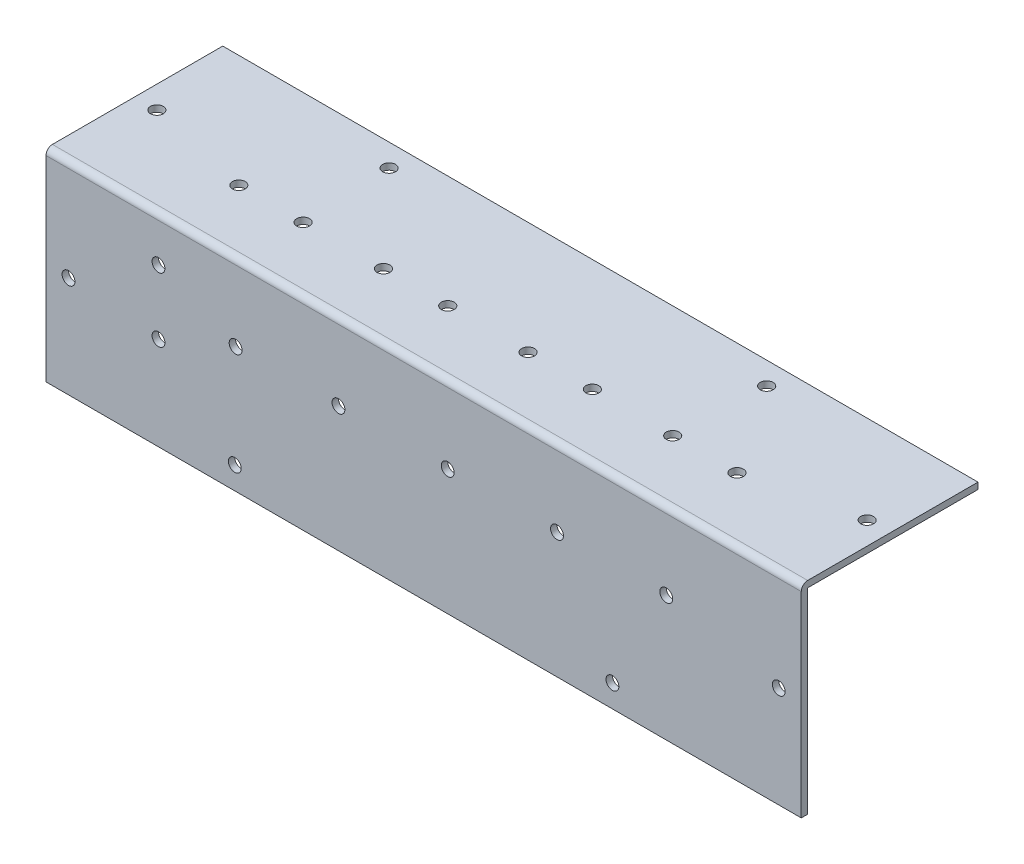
SolidWorks part; units mm, degrees
ref_plane "Plan de face" through (0, 0, 0) normal (0, 0, 1) x (1, 0, 0)
ref_plane "Plan de dessus" through (0, 0, 0) normal (0, 1, 0) x (1, 0, 0)
ref_plane "Plan de droite" through (0, 0, 0) normal (1, 0, 0) x (0, 0, -1)
sketch "Esquisse1" plane through (0, 0, 0) normal (0, 0, 1) x (1, 0, 0)
  line L1 (0, 0) -> (235, 0)
  line L2 (0, 0) -> (0, 61)
  line L3 (0, 61) -> (235, 61)
  line L4 (235, 0) -> (235, 61)
  dimension "D1" = 235
  dimension "D2" = 61
extrude "Boss.-Extru.1" add sketch "Esquisse1" along normal blind 2
sketch "Esquisse2" plane through (0, 0, 2) normal (0, 0, 1) x (1, 0, 0)
  line L0 (235, 0) -> (235, 61) construction
  line L1 (0, 61) -> (235, 61)
  line L2 (0, 61) -> (0, 63)
  line L3 (0, 63) -> (235, 63)
  line L4 (235, 61) -> (235, 63)
  dimension "D1" = 235
  dimension "D2" = 2
extrude "Boss.-Extru.2" add sketch "Esquisse2" against normal blind 55
sketch "Esquisse4" plane through (0, 0, 2) normal (0, 0, 1) x (1, 0, 0)
  line L0 (0, 0) -> (0, 15) construction
  line L1 (0, 63) -> (0, 0) construction
  line L2 (0, 15) -> (0, 0) construction
  line L3 (0, 15) -> (15, 15) construction
  line L4 (235, 63) -> (220, 63) construction
  line L5 (235, 63) -> (0, 63) construction
  line L6 (15, 15) -> (220, 15) construction
  line L7 (220, 15) -> (220, 63) construction
  line L8 (15, 15) -> (15, 63) construction
  line L9 (0, 31.5) -> (7, 31.5) construction
  line L10 (117.5, 0) -> (0, 0) construction
  line L11 (0, 0) -> (235, 0) construction
  line L12 (58.75, 0) -> (58.75, 7) construction
  line L13 (117.5, 0) -> (235, 0) construction
  line L14 (235, 0) -> (176.25, 0) construction
  line L15 (176.25, 0) -> (176.25, 7) construction
  line L16 (235, 31.5) -> (228, 31.5) construction
  line L17 (235, 0) -> (235, 63) construction
  line L18 (15, 39) -> (35, 39) construction
  line L19 (35, 39) -> (59, 39) construction
  line L20 (59, 39) -> (91, 39) construction
  line L23 (91, 39) -> (125, 39) construction
  line L24 (125, 39) -> (159, 39) construction
  line L25 (159, 39) -> (193, 39) construction
  line L26 (35, 39) -> (35, 49) construction
  line L27 (35, 39) -> (35, 29) construction
  circle A0 centre (7, 31.5) radius 2
  circle A1 centre (228, 31.5) radius 2
  circle A2 centre (176.25, 7) radius 2
  circle A3 centre (58.75, 7) radius 2
  circle A4 centre (59, 39) radius 2
  circle A7 centre (91, 39) radius 2
  circle A8 centre (125, 39) radius 2
  circle A9 centre (159, 39) radius 2
  circle A10 centre (193, 39) radius 2
  circle A11 centre (35, 49) radius 2
  circle A12 centre (35, 29) radius 2
  dimension "D5" = 4
  dimension "D9" = 4
  dimension "D10" = 4
  dimension "D11" = 4
  dimension "D14" = 10
  dimension "D18" = 4
  dimension "D19" = 4
  dimension "D20" = 4
  dimension "D24" = 4
  dimension "D25" = 4
  dimension "D26" = 4
  dimension "D17" = 4
  dimension "D1" = 15
  dimension "D2" = 15
  dimension "D3" = 15
  dimension "D4" = 7
  dimension "D6" = 7
  dimension "D7" = 7
  dimension "D8" = 7
  dimension "D12" = 20
  dimension "D13" = 24
  dimension "D15" = 32
  dimension "D16" = 10
  dimension "D21" = 34
  dimension "D22" = 34
  dimension "D23" = 34
extrude "Enlèv. mat.-Extru.1" cut sketch "Esquisse4" against normal up to next
sketch "Esquisse5" plane through (0, 63, 0) normal (0, 1, 0) x (1, 0, 0)
  line L0 (0, 53) -> (15, 53) construction
  line L1 (235, 53) -> (0, 53) construction
  line L2 (15, 53) -> (15, 38) construction
  line L3 (235, 53) -> (235, 38) construction
  line L4 (235, 53) -> (235, -2) construction
  line L5 (235, 38) -> (220, 38) construction
  line L6 (15, 38) -> (220, 38) construction
  line L7 (220, 38) -> (220, -2) construction
  line L8 (235, -2) -> (0, -2) construction
  line L9 (15, 38) -> (15, -2) construction
  line L10 (15, 18) -> (40, 18) construction
  line L11 (40, 18) -> (60, 18) construction
  line L12 (60, 18) -> (85, 18) construction
  line L13 (85, 18) -> (105, 18) construction
  line L14 (105, 18) -> (130, 18) construction
  line L15 (130, 18) -> (150, 18) construction
  line L16 (150, 18) -> (175, 18) construction
  line L17 (175, 18) -> (195, 18) construction
  line L18 (195, 18) -> (219.9204, 16.0064) construction
  circle A0 centre (40, 18) radius 2
  circle A1 centre (60, 18) radius 2
  circle A2 centre (85, 18) radius 2
  circle A3 centre (105, 18) radius 2
  circle A4 centre (130, 18) radius 2
  circle A5 centre (150, 18) radius 2
  circle A6 centre (175, 18) radius 2
  circle A7 centre (195, 18) radius 2
  dimension "D7" = 4
  dimension "D8" = 4
  dimension "D15" = 4
  dimension "D16" = 4
  dimension "D17" = 4
  dimension "D18" = 4
  dimension "D19" = 4
  dimension "D20" = 4
  dimension "D1" = 15
  dimension "D2" = 15
  dimension "D3" = 15
  dimension "D4" = 15
  dimension "D5" = 25
  dimension "D6" = 20
  dimension "D9" = 25
  dimension "D10" = 20
  dimension "D11" = 25
  dimension "D12" = 20
  dimension "D13" = 25
  dimension "D14" = 20
  dimension "D21" = 25
extrude "Enlèv. mat.-Extru.2" cut sketch "Esquisse5" against normal blind 40
sketch "Esquisse6" plane through (0, 63, 0) normal (0, 1, 0) x (1, 0, 0)
  line L0 (0, 25.5) -> (7, 25.5) construction
  line L1 (0, 53) -> (0, -2) construction
  line L2 (0, 53) -> (117.5, 53) construction
  line L3 (235, 53) -> (0, 53) construction
  line L4 (117.5, 53) -> (235, 53) construction
  line L5 (58.75, 53) -> (58.75, 46) construction
  line L6 (176.25, 53) -> (176.25, 46) construction
  line L7 (235, 25.5) -> (228, 25.5) construction
  line L8 (235, 53) -> (235, -2) construction
  circle A0 centre (228, 25.5) radius 2
  circle A1 centre (176.25, 46) radius 2
  circle A2 centre (58.75, 46) radius 2
  circle A3 centre (7, 25.5) radius 2
  dimension "D5" = 4
  dimension "D6" = 4
  dimension "D7" = 4
  dimension "D8" = 4
  dimension "D1" = 7
  dimension "D2" = 7
  dimension "D3" = 7
  dimension "D4" = 7
extrude "Enlèv. mat.-Extru.3" cut sketch "Esquisse6" against normal blind 40
fillet "Congé1" radius 2 1 edges at (117.5, 63, 2)
